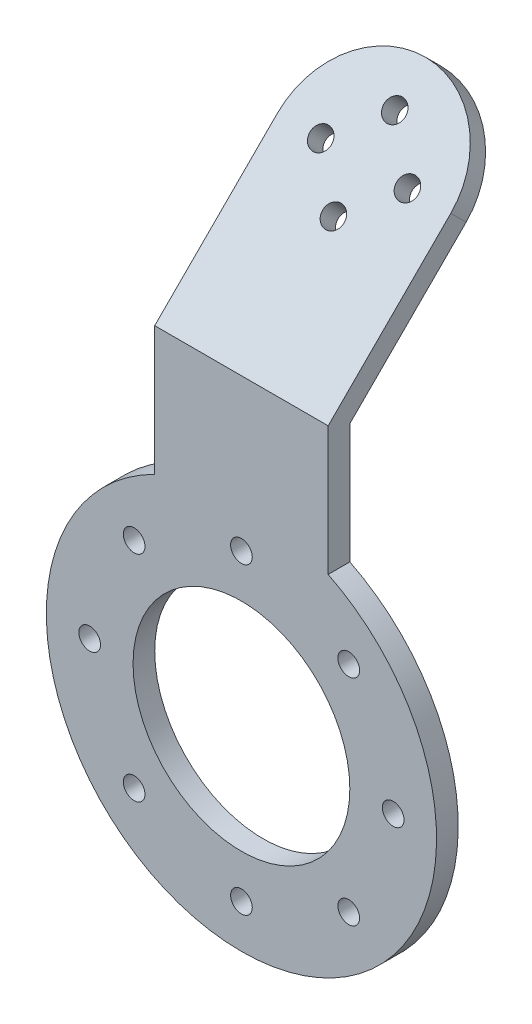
SolidWorks part; units mm, degrees
ref_plane "Front Plane" through (0, 0, 0) normal (0, 0, 1) x (1, 0, 0)
ref_plane "Top Plane" through (0, 0, 0) normal (0, 1, 0) x (1, 0, 0)
ref_plane "Right Plane" through (0, 0, 0) normal (1, 0, 0) x (0, 0, -1)
sketch "Sketch1" plane through (0, 0, 0) normal (0, 0, 1) x (1, 0, 0)
  line L0 (0, 64.2293) -> (0, 0) construction
  line L2 (-12.7, 25.5977) -> (-12.7, 44.45)
  line L3 (-12.7, 44.45) -> (12.7, 44.45)
  line L4 (12.7, 25.5977) -> (12.7, 44.45)
  circle A0 centre (0, 0) radius 15.875
  arc A1 (-12.7, 25.5977) -> (12.7, 25.5977) centre (0, 0) ccw
  dimension "D1" = 31.75
  dimension "D2" = 57.15
  dimension "D3" = 44.45
  dimension "D4" = 25.4
extrude "Extrude1" add sketch "Sketch1" along normal blind 3.175
ref_plane "Plane1" through (0, 23.8125, 23.8125) normal (0, 0.7071, 0.7071) x (-1, 0, 0)
sketch "Sketch2" plane through (0, 23.8125, 23.8125) normal (0, 0.7071, 0.7071) x (-1, 0, 0)
  line L0 (12.7, -29.1858) -> (12.7, -54.5858)
  line L1 (-12.7, -54.5858) -> (-12.7, -29.1858)
  line L2 (-12.7, -29.1858) -> (12.7, -29.1858) construction
  line L3 (12.7, -29.1858) -> (-12.7, -29.1858)
  arc A0 (12.7, -54.5858) -> (-12.7, -54.5858) centre (0, -54.5858) cw
  dimension "D2" = 25.4
extrude "Extrude2" add sketch "Sketch2" against normal blind 3.175
sketch "Sketch3" plane through (0, 0, 3.175) normal (0, 0, 1) x (1, 0, 0)
  line L0 (0, 0) -> (0, 59.0296) construction
  circle A0 centre (0, 0) radius 22.225 construction
  circle A1 centre (0, 22.225) radius 1.5875
  dimension "D1" = 3.175
extrude "Extrude3" cut sketch "Sketch3" against normal through all
pattern_circular "CirPattern1" count 8 over 360 about axis through (0, 0, 0) along (0, 0, 1) of "Extrude3"
sketch "Sketch4" plane through (0, 23.8125, 23.8125) normal (0, 0.7071, 0.7071) x (1, 0, 0)
  line L0 (0, 54.5858) -> (0, 81.8829) construction
  circle A0 centre (0, 54.5858) radius 6.35 construction
  circle A1 centre (0, 60.9358) radius 1.5875
  dimension "D1" = 12.7
  dimension "D2" = 3.175
extrude "Extrude4" cut sketch "Sketch4" against normal through all
pattern_circular "CirPattern2" count 4 over 360 about axis through (0, 38.598, -38.598) along (0, 0.7071, 0.7071) of "Extrude4"
